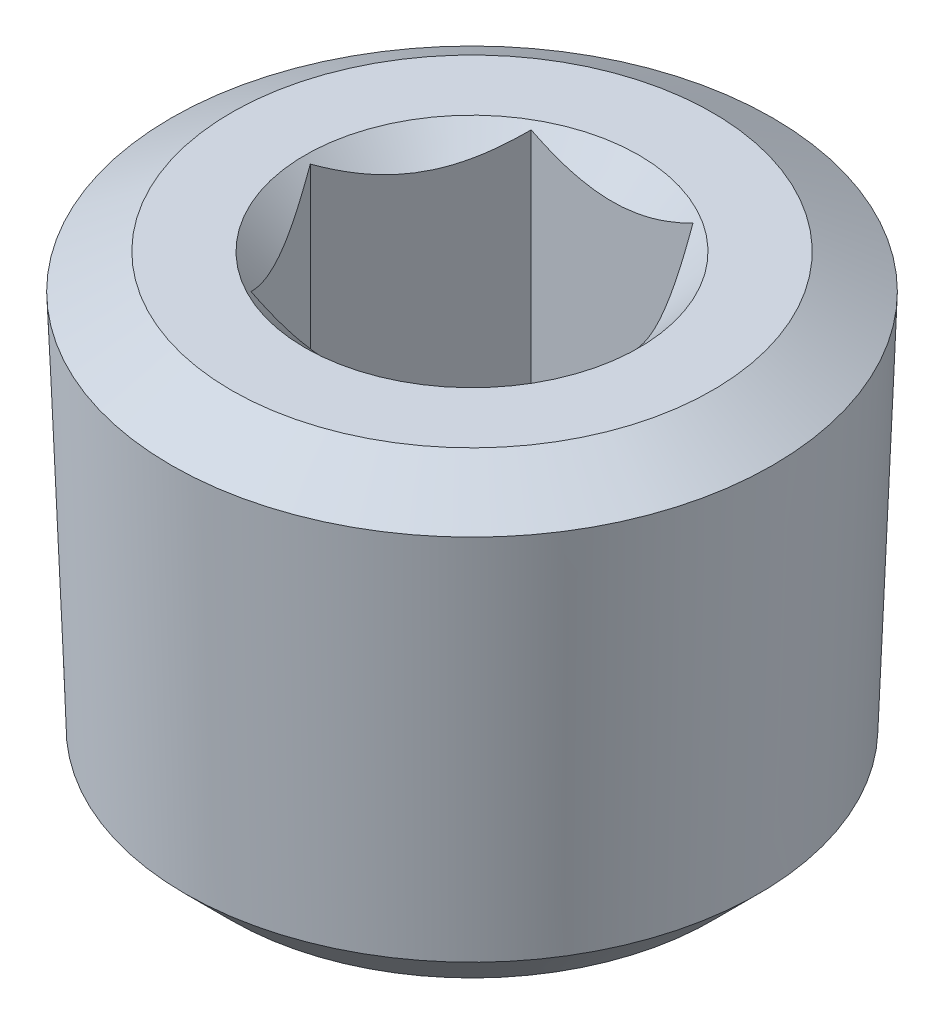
SolidWorks part; units mm, degrees
ref_plane "Front Plane" through (0, 0, 0) normal (0, 0, 1) x (1, 0, 0)
ref_plane "Top Plane" through (0, 0, 0) normal (0, 1, 0) x (1, 0, 0)
ref_plane "Right Plane" through (0, 0, 0) normal (1, 0, 0) x (0, 0, -1)
sketch "Sketch2" plane through (0, 0, 0) normal (0, 0, 1) x (1, 0, 0)
  line L0 (0, 10.7443) -> (0, -17.0657) construction
  line L1 (0, 0) -> (-6.8274, 0)
  line L2 (-8.5365, -0.9867) -> (-8.1455, -11.7121)
  line L3 (-6.8274, -13.0302) -> (0, -13.0302)
  line L4 (0, -13.0302) -> (0, 0)
  line L6 (-6.8274, -13.0302) -> (-8.1455, -11.7121)
  line L7 (-6.8274, 0) -> (-8.5365, -0.9867)
  point P4 (-8.5725, 0)
  point P6 (-8.0974, -13.0302)
  dimension "D1" = 13.0302
  dimension "D2" = 2.088
  dimension "D3" = 17.145
  dimension "D4" = 30
  dimension "D5" = 1.27
  dimension "D6" = 45
revolve "Revolve1" add sketch "Sketch2" angle 360 about L0
sketch "Sketch3" plane through (0, 0, 0) normal (0, 0, 1) x (1, 0, 0)
  line L0 (0, 2.9342) -> (0, -10.6171) construction
  line L1 (0, 0) -> (-4.7371, 0)
  line L2 (6.8274, 0) -> (-6.8274, 0) construction
  line L3 (-3.9751, -0.762) -> (-3.9751, -8.128)
  line L4 (-3.9751, -8.128) -> (-0.5933, -10.16)
  line L5 (0, -10.16) -> (0, 0)
  line L6 (-3.9751, -0.762) -> (-4.7371, 0)
  line L7 (-0.5933, -10.16) -> (0, -10.16)
  dimension "D1" = 8.128
  dimension "D2" = 59
  dimension "D3" = 7.9502
  dimension "D4" = 0.762
  dimension "D5" = 45
  dimension "D6" = 10.16
revolve "Cut-Revolve1" cut sketch "Sketch3" angle 360 about L0
sketch "Sketch4" plane through (0, 0, 0) normal (0, 1, 0) x (1, 0, 0)
  line L1 (-2.295, -3.9751) -> (2.295, -3.9751)
  line L2 (2.295, -3.9751) -> (4.5901, 0)
  line L3 (4.5901, 0) -> (2.295, 3.9751)
  line L4 (2.295, 3.9751) -> (-2.295, 3.9751)
  line L5 (-2.295, 3.9751) -> (-4.5901, 0)
  line L6 (-4.5901, 0) -> (-2.295, -3.9751)
  circle A0 centre (0, 0) radius 3.9751 construction
  circle A1 centre (0, 0) radius 3.9751 construction
extrude "Cut-Extrude1" cut sketch "Sketch4" against normal up to vertex (5.2929 mm away)
